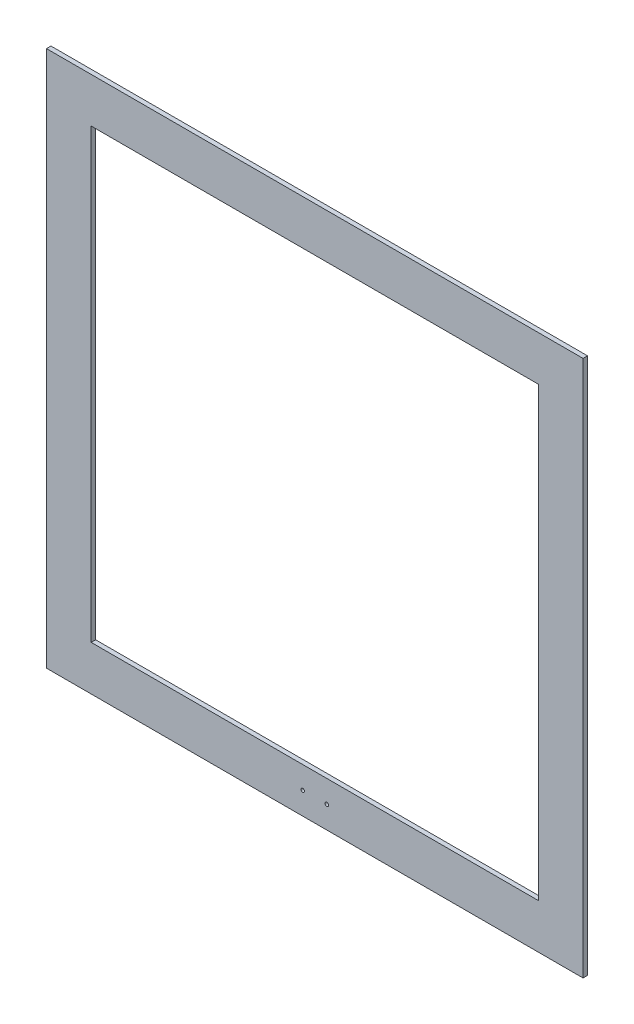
SolidWorks part; units mm, degrees
ref_plane "Front" through (0, 0, 0) normal (0, 0, 1) x (1, 0, 0)
ref_plane "Top" through (0, 0, 0) normal (0, 1, 0) x (1, 0, 0)
ref_plane "Right" through (0, 0, 0) normal (1, 0, 0) x (0, 0, -1)
sketch "Esquisse1" plane through (0, 0, 0) normal (0, 0, 1) x (1, 0, 0)
  line L1 (-250, 250) -> (250, 250)
  line L2 (-250, 250) -> (-250, -250)
  line L3 (-250, -250) -> (250, -250)
  line L4 (250, 250) -> (250, -250)
  line L5 (-250, 250) -> (250, -250) construction
  line L6 (-250, -250) -> (250, 250) construction
  line L7 (-300, 300) -> (300, 300)
  line L8 (-300, 300) -> (-300, -300)
  line L9 (-300, -300) -> (300, -300)
  line L10 (300, 300) -> (300, -300)
  line L11 (-300, 300) -> (300, -300) construction
  line L12 (-300, -300) -> (300, 300) construction
  point P0 (0, 0)
  point P6 (-250, 0)
  point P7 (0, 0)
  dimension "D1" = 500
  dimension "D2" = 500
  dimension "D3" = 50
  dimension "D4" = 50
extrude "Boss.-Extru.1" add sketch "Esquisse1" along normal blind 5
sketch "Esquisse2" plane through (0, 0, 5) normal (0, 0, 1) x (1, 0, 0)
  line L0 (0, -250) -> (0, -300) construction
  line L1 (-250, -250) -> (250, -250) construction
  line L2 (-300, -300) -> (300, -300) construction
  line L3 (0, -275) -> (-13.5, -275) construction
  circle A0 centre (-13.5, -275) radius 2
  circle A1 centre (13.5, -275) radius 2
  dimension "D2" = 4
  dimension "D1" = 13.5
extrude "Enlèv. mat.-Extru.1" cut sketch "Esquisse2" against normal up to next
